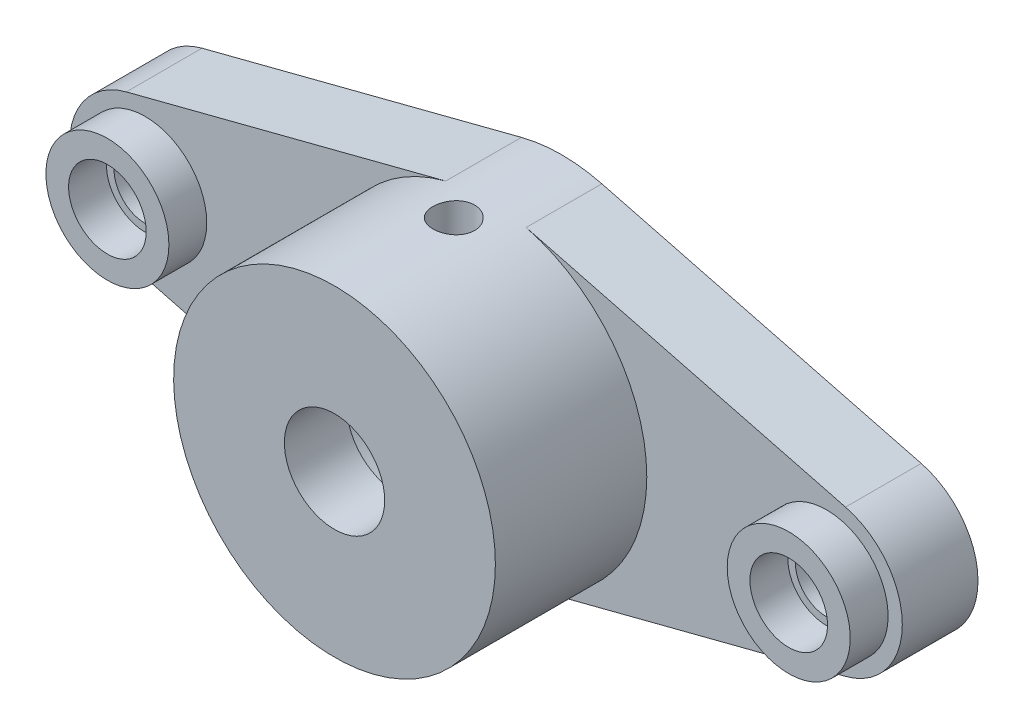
SolidWorks part; units mm, degrees
ref_plane "前视基准面" through (0, 0, 0) normal (0, 0, 1) x (1, 0, 0)
ref_plane "上视基准面" through (0, 0, 0) normal (0, 1, 0) x (1, 0, 0)
ref_plane "右视基准面" through (0, 0, 0) normal (1, 0, 0) x (0, 0, -1)
sketch "草图1" plane through (0, 0, 0) normal (0, 0, 1) x (1, 0, 0)
  line L0 (0, 0) -> (-18, 0) construction
  line L1 (0, 0) -> (0, 20.1334) construction
  line L2 (-19, 3.873) -> (-2.125, 8.2301)
  line L3 (-19, -3.873) -> (-2.125, -8.2301)
  line L4 (19, -3.873) -> (2.125, -8.2301)
  line L5 (19, 3.873) -> (2.125, 8.2301)
  arc A0 (2.125, 8.2301) -> (-2.125, 8.2301) centre (0, 0) ccw
  circle A1 centre (0, 0) radius 5.25
  circle A2 centre (-18, 0) radius 1
  arc A3 (-19, 3.873) -> (-19, -3.873) centre (-18, 0) ccw
  circle A4 centre (18, 0) radius 1
  arc A5 (19, 3.873) -> (19, -3.873) centre (18, 0) cw
  arc A6 (-2.125, -8.2301) -> (2.125, -8.2301) centre (0, 0) ccw
  dimension "D2" = 10.5
  dimension "D3" = 17
  dimension "D4" = 2
  dimension "D5" = 8
  dimension "D1" = 18
extrude "凸台-拉伸1" add sketch "草图1" along normal blind 4
sketch "草图4" plane through (0, 0, 4) normal (0, 0, 1) x (1, 0, 0)
  point P0 (-18, 0)
  point P1 (18, 0)
hole_wizard "M4 螺纹孔1" positions "3D草图4" profile "草图5" tap size "M4" standard "GB"
sketch3d "3D草图4"
  point P0 (-18, 0, 4)
  point P3 (18, 0, 4)
sketch "草图5" plane through (-18, 0, 4) normal (1, 0, 0) x (0, -1, 0)
  line L0 (0, 0) -> (0, 4)
  line L1 (0, 4) -> (1.65, 4)
  line L2 (1.65, 4) -> (1.65, 0)
  line L5 (1.65, 0) -> (0, 0)
  line L11 (0, -6.35) -> (0, 107.95) construction
  dimension "通孔螺纹孔钻头直径" = 3.3
  dimension "通孔螺纹孔钻头深度" = 4
sketch "草图6" plane through (0, 0, 4) normal (0, 0, 1) x (1, 0, 0)
  circle A0 centre (0, 0) radius 5.25
  circle A1 centre (0, 0) radius 8.5
extrude "凸台-拉伸2" add sketch "草图6" along normal blind 8
sketch "草图7" plane through (0, 0, 12) normal (0, 0, 1) x (1, 0, 0)
  circle A0 centre (0, 0) radius 2.65
  circle A1 centre (0, 0) radius 5.25 construction
  circle A2 centre (0, 0) radius 5.25
  dimension "D1" = 5.3
extrude "凸台-拉伸3" add sketch "草图7" against normal blind 3.3
sketch "草图8" plane through (0, 0, 0) normal (0, 1, 0) x (1, 0, 0)
  line L0 (-29.3723, -5.7) -> (19.2944, -5.7) construction
  line L1 (5.25, -8.7) -> (-5.25, -8.7) construction
  line L2 (0, 0) -> (0, -12) construction
  line L3 (-8.5, -12) -> (8.5, -12) construction
  circle A0 centre (0, -5.7) radius 1.1
  point P9 (0, -5.7)
  dimension "D2" = 2.2
  dimension "D1" = 3
extrude "切除-拉伸1" cut sketch "草图8" against normal mid plane 29.3
sketch "草图9" plane through (0, 0, 4) normal (0, 0, 1) x (1, 0, 0)
  line L0 (0, 0) -> (0, 12.8402) construction
  circle A0 centre (-18, 0) radius 2.05
  circle A1 centre (-18, 0) radius 3.25
  circle A2 centre (18, 0) radius 3.25
  circle A3 centre (18, 0) radius 2.05
  dimension "D1" = 4.1
  dimension "D2" = 6.5
extrude "凸台-拉伸4" add sketch "草图9" along normal blind 2
